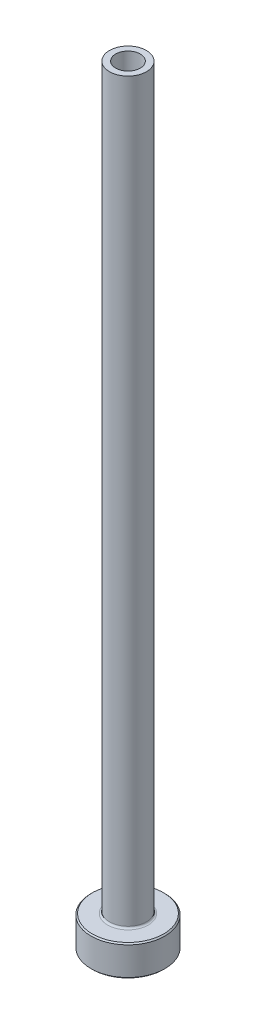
SolidWorks part; units mm, degrees
ref_plane "Front Plane" through (0, 0, 0) normal (0, 0, 1) x (1, 0, 0)
ref_plane "Top Plane" through (0, 0, 0) normal (0, 1, 0) x (1, 0, 0)
ref_plane "Right Plane" through (0, 0, 0) normal (1, 0, 0) x (0, 0, -1)
sketch "Sketch1" plane through (0, 0, 0) normal (0, 0, 1) x (1, 0, 0)
  line L0 (-2, 125) -> (-3, 125)
  line L1 (-3, 125) -> (-3, 5)
  line L2 (-3, 5) -> (-6, 5)
  line L3 (-6, 5) -> (-6, 0)
  line L4 (6.6, 0) -> (-6.6, 0) construction
  line L5 (-6, 0) -> (-2.25, 0)
  line L6 (-2, 80) -> (-2, 125)
  line L7 (0, 92.1877) -> (0, -15.5353) construction
  line L8 (0, -6.6) -> (0, 6.6) construction
  line L9 (-2, 80) -> (-2.25, 68)
  line L10 (-2.25, 68) -> (-2.25, 0)
  dimension "D1" = 0.25
  dimension "ID" = 4
  dimension "OD" = 6
  dimension "L" = 125
  dimension "H" = 12
  dimension "T" = 5
  dimension "N" = 45
  dimension "D2" = 12
revolve "Revolve1" add sketch "Sketch1" angle 360 about L7
fillet "Fillet1" radius 0.3 1 edges at (0, 5, 3)
chamfer "Chamfer1" distance 0.2 angle 45 2 edges at (0, 5, 6) (0, 0, 6)
chamfer "Chamfer3" distance 0.5 angle 45 1 edges at (0, 0, 2.25)
